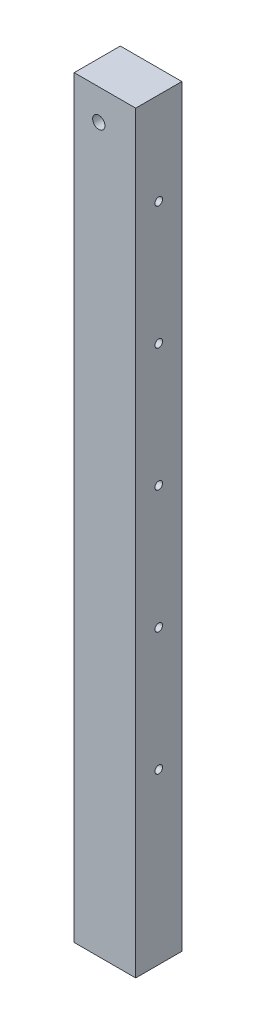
SolidWorks part; units mm, degrees
ref_plane "Front" through (0, 0, 0) normal (0, 0, 1) x (1, 0, 0)
ref_plane "Top" through (0, 0, 0) normal (0, 1, 0) x (1, 0, 0)
ref_plane "Right" through (0, 0, 0) normal (1, 0, 0) x (0, 0, -1)
sketch "草图1" plane through (0, 0, 0) normal (0, 1, 0) x (1, 0, 0)
  line L1 (0, 0) -> (20, 0)
  line L2 (0, 0) -> (0, 15)
  line L3 (0, 15) -> (20, 15)
  line L4 (20, 0) -> (20, 15)
  dimension "D1" = 20
  dimension "D2" = 15
extrude "凸台-拉伸1" add sketch "草图1" along normal blind 245
hole_wizard "Ø2.5 (2.5) 直径孔1" positions "草图4" profile "草图5" hole size "Ø2.5" standard "GB"
sketch "草图4" plane through (0, 0, 0) normal (-1, 0, 0) x (0, 0, 1)
  point P0 (-7.5, 55)
  point P3 (-7.5, 95)
  point P6 (-7.5, 135)
  point P9 (-7.5, 175)
  point P12 (-7.5, 215)
sketch "草图5" plane through (0, 55, -7.5) normal (0, 1, 0) x (0, 0, 1)
  line L0 (0, 0) -> (0, 20)
  line L1 (0, 20) -> (1.25, 20)
  line L2 (1.25, 20) -> (1.25, 0)
  line L5 (1.25, 0) -> (0, 0)
  line L11 (0, -6.35) -> (0, 107.95) construction
  dimension "通孔孔直径" = 2.5
  dimension "通孔孔深度" = 20
hole_wizard "Ø4.0 (4) 直径孔1" positions "草图6" profile "草图7" hole size "Ø4.0" standard "GB"
sketch "草图6" plane through (0, 0, 0) normal (0, 0, 1) x (1, 0, 0)
  point P0 (8, 235)
  point P3 (152, 235)
sketch "草图7" plane through (8, 235, 0) normal (1, 0, 0) x (0, -1, 0)
  line L0 (0, 0) -> (0, 15)
  line L1 (0, 15) -> (2, 15)
  line L2 (2, 15) -> (2, 0)
  line L5 (2, 0) -> (0, 0)
  line L11 (0, -6.35) -> (0, 107.95) construction
  dimension "通孔孔直径" = 4
  dimension "通孔孔深度" = 15
